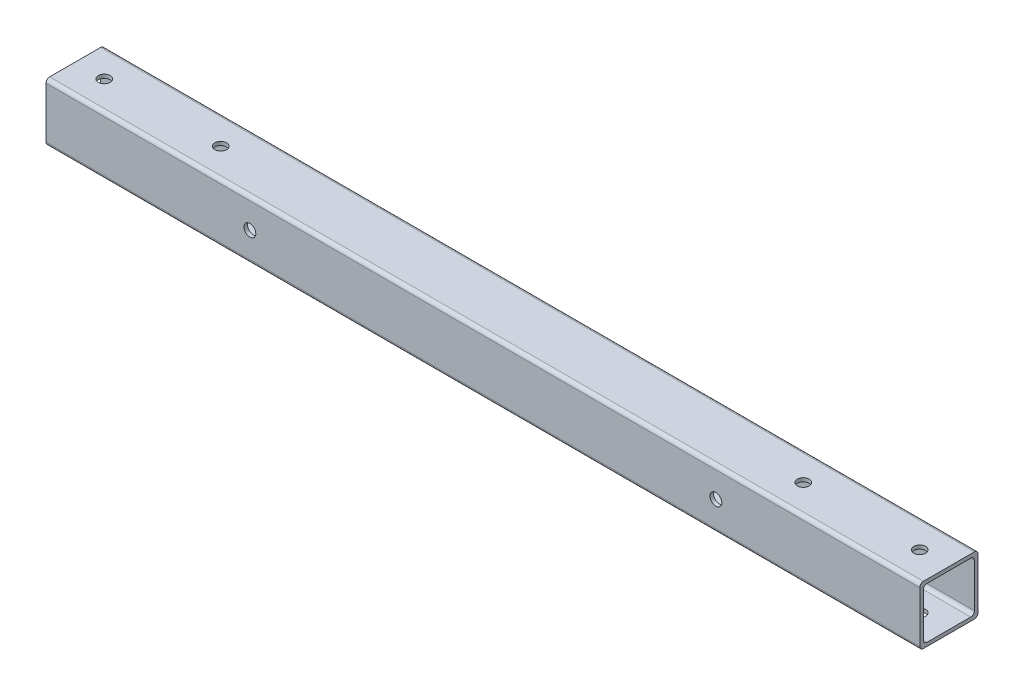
SolidWorks part; units mm, degrees
ref_plane "Front Plane" through (0, 0, 0) normal (0, 0, 1) x (1, 0, 0)
ref_plane "Top Plane" through (0, 0, 0) normal (0, 1, 0) x (1, 0, 0)
ref_plane "Right Plane" through (0, 0, 0) normal (1, 0, 0) x (0, 0, -1)
sketch "Sketch1" plane through (0, 0, 0) normal (0, 1, 0) x (1, 0, 0)
  line L1 (0, 0) -> (-1524, 0)
  line L2 (0, 0) -> (0, -101.6)
  line L3 (0, -101.6) -> (-1524, -101.6)
  line L4 (-1524, 0) -> (-1524, -101.6)
  dimension "D1" = 1524
  dimension "D2" = 101.6
extrude "Extrude1" add sketch "Sketch1" along normal blind 101.6
sketch "Sketch2" plane through (-1524, 0, 0) normal (-1, 0, 0) x (0, 0, 1)
  line L0 (0, 101.6) -> (101.6, 101.6) construction
  line L1 (6.35, 95.25) -> (95.25, 95.25)
  line L2 (6.35, 95.25) -> (6.35, 6.35)
  line L3 (6.35, 6.35) -> (95.25, 6.35)
  line L4 (95.25, 95.25) -> (95.25, 6.35)
  line L5 (0, 0) -> (101.6, 0) construction
  line L6 (101.6, 101.6) -> (101.6, 0) construction
  line L7 (0, 101.6) -> (0, 0) construction
  dimension "D1" = 6.35
  dimension "D2" = 6.35
  dimension "D3" = 6.35
  dimension "D4" = 6.35
extrude "Cut-Extrude1" cut sketch "Sketch2" against normal up to next
fillet "Fillet1" radius 6.35 8 edges at (-762, 6.35, 95.25) (-762, 0, 101.6) (-762, 101.6, 101.6) (-762, 95.25, 95.25) (-762, 95.25, 6.35) (-762, 101.6, 0) (-762, 6.35, 6.35) (-762, 0, 0)
sketch "Sketch3" plane through (0, 0, 0) normal (0, -1, 0) x (1, 0, 0)
  line L0 (0, 95.25) -> (0, 6.35) construction
  line L1 (-1524, 6.35) -> (0, 6.35) construction
  circle A0 centre (-1473.2, 50.8) radius 10.3188
  dimension "D1" = 20.6375
  dimension "D2" = 1473.2
  dimension "D3" = 44.45
extrude "Cut-Extrude2" cut sketch "Sketch3" against normal blind 101.6
sketch "Sketch4" plane through (0, 0, 0) normal (0, -1, 0) x (1, 0, 0)
  line L0 (0, 95.25) -> (0, 6.35) construction
  line L1 (-1524, 6.35) -> (0, 6.35) construction
  circle A0 centre (-1270, 50.8) radius 10.3188
  dimension "D1" = 20.6375
  dimension "D2" = 1270
  dimension "D3" = 44.45
extrude "Cut-Extrude3" cut sketch "Sketch4" against normal blind 101.6
sketch "Sketch5" plane through (0, 0, 101.6) normal (0, 0, 1) x (1, 0, 0)
  line L0 (0, 95.25) -> (0, 6.35) construction
  line L1 (-1524, 6.35) -> (0, 6.35) construction
  circle A0 centre (-1168.4, 50.8) radius 10.3188
  dimension "D1" = 20.6375
  dimension "D2" = 1168.4
  dimension "D3" = 44.45
extrude "Cut-Extrude4" cut sketch "Sketch5" against normal blind 101.6
ref_plane "Plane1" through (-762, 0, 0) normal (1, 0, 0) x (0, 0, -1)
mirror "Mirror1" about plane through (-762, 0, 0) normal (1, 0, 0) of "Cut-Extrude4", "Cut-Extrude3", "Cut-Extrude2"
